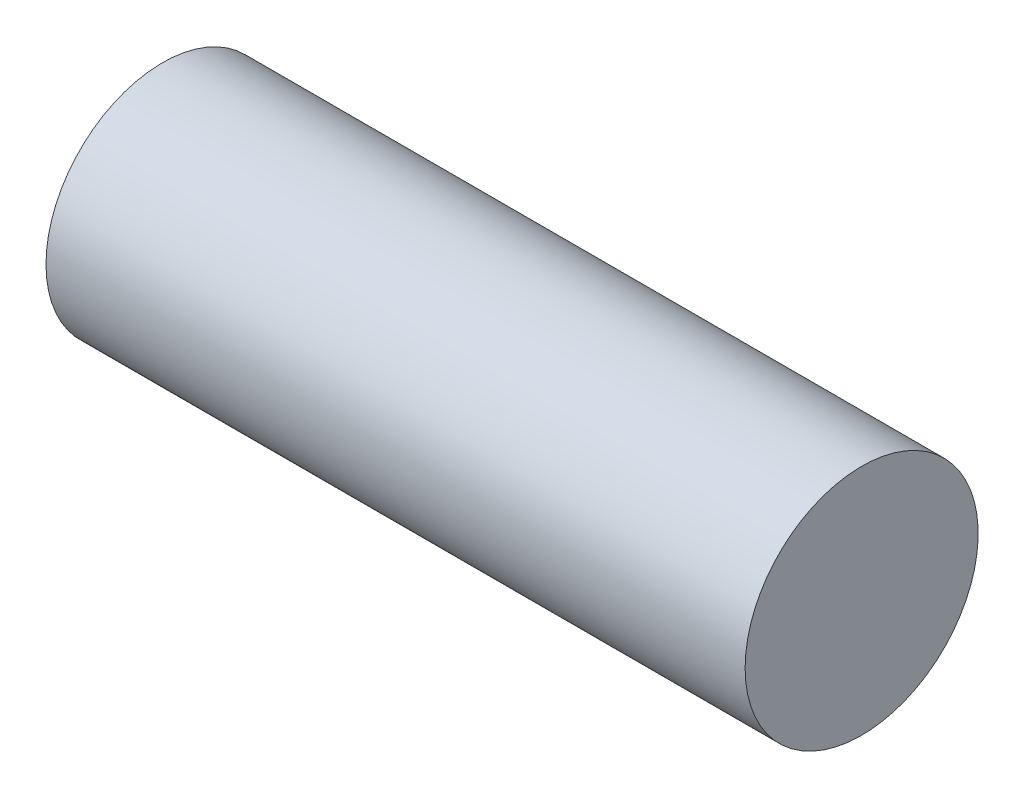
SolidWorks part; units mm, degrees
ref_plane "Front" through (0, 0, 0) normal (0, 0, 1) x (1, 0, 0)
ref_plane "Top" through (0, 0, 0) normal (0, 1, 0) x (1, 0, 0)
ref_plane "Right" through (0, 0, 0) normal (1, 0, 0) x (0, 0, -1)
sketch "Sketch1" plane through (0, 0, 0) normal (1, 0, 0) x (0, 0, -1)
  circle A0 centre (0, 0) radius 3.175
  dimension "D1" = 6.35
extrude "Base-Extrude" add sketch "Sketch1" along normal mid plane 19.05
